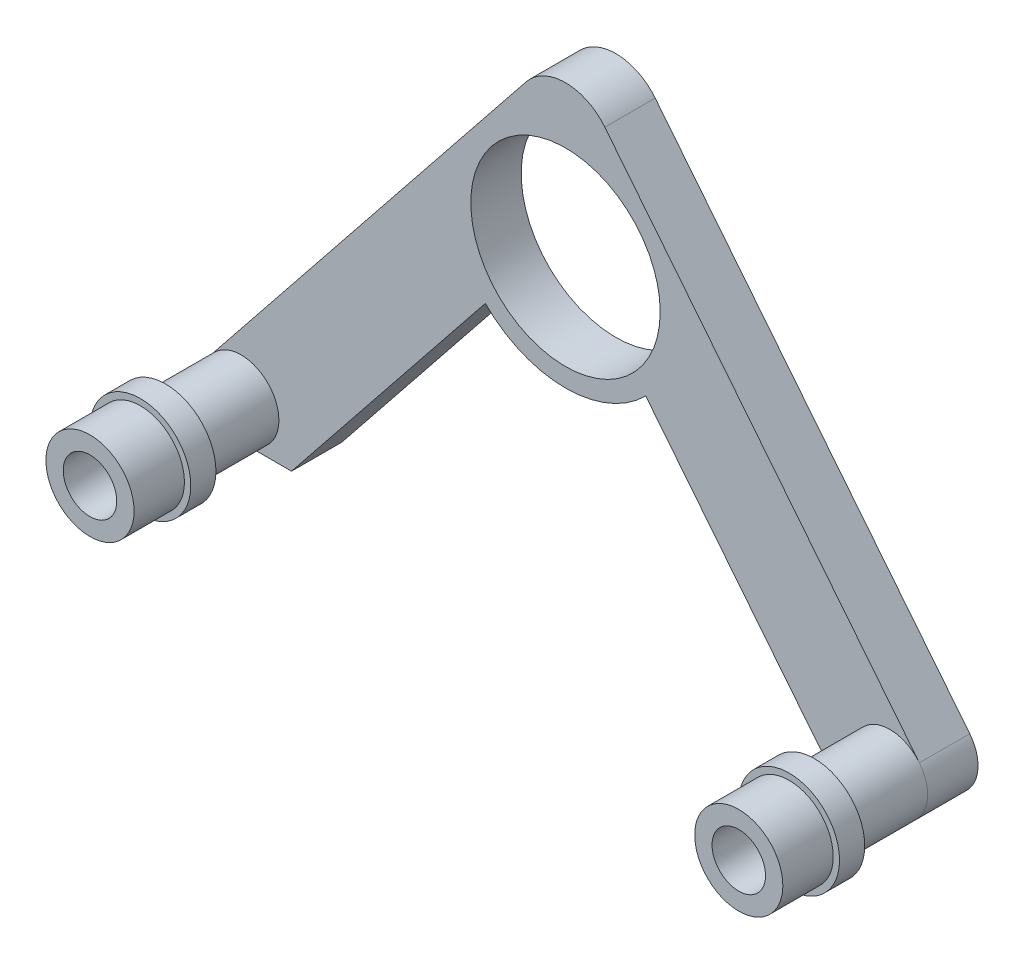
SolidWorks part; units mm, degrees
ref_plane "Front Plane" through (0, 0, 0) normal (0, 0, 1) x (1, 0, 0)
ref_plane "Top Plane" through (0, 0, 0) normal (0, 1, 0) x (1, 0, 0)
ref_plane "Right Plane" through (0, 0, 0) normal (1, 0, 0) x (0, 0, -1)
sketch "Sketch1" plane through (0, 0, 0) normal (0, 0, 1) x (1, 0, 0)
  line L0 (-101.6, 0) -> (0, 127)
  line L3 (-101.6, 0) -> (101.6, 0)
  line L7 (0, 127) -> (101.6, 0)
  point P0 (0, 0)
  point P4 (0, 0)
  dimension "D1" = 203.2
  dimension "D2" = 127
extrude "Boss-Extrude1" add sketch "Sketch1" along normal blind 12.7
sketch "Sketch2" plane through (0, 0, 12.7) normal (0, 0, 1) x (1, 0, 0)
  line L0 (-69.0721, 0) -> (0, 86.3402)
  line L1 (-101.6, 0) -> (101.6, 0) construction
  line L2 (0, 86.3402) -> (69.0721, 0)
  line L3 (69.0721, 0) -> (-69.0721, 0)
  line L4 (0, 127) -> (-101.6, 0) construction
  line L5 (101.6, 0) -> (0, 127) construction
  point P4 (0, 0)
  dimension "D1" = 25.4
extrude "Cut-Extrude1" cut sketch "Sketch2" against normal blind 12.7
sketch "Sketch3" plane through (0, 0, 0) normal (0, 0, -1) x (-1, 0, 0)
  line L0 (0, 127) -> (101.6, 0) construction
  line L1 (-101.6, 0) -> (0, 127) construction
  circle A0 centre (0, 81.2577) radius 28.575
  dimension "D1" = 57.15
sketch "Sketch4" plane through (0, 0, 12.7) normal (0, 0, 1) x (1, 0, 0)
  line L0 (0, 127) -> (-101.6, 0) construction
  line L1 (-101.6, 0) -> (-69.0721, 0) construction
  line L2 (101.6, 0) -> (0, 127) construction
  line L3 (69.0721, 0) -> (101.6, 0) construction
  circle A0 centre (-81.782, 9.525) radius 9.525
  circle A1 centre (81.782, 9.525) radius 9.525
  dimension "D1" = 19.05
  dimension "D2" = 19.05
extrude "Boss-Extrude3" add sketch "Sketch4" along normal blind 38.1
fillet "Fillet2" radius 12.7 1 edges at (0, 127, 6.35)
fillet "Fillet3" radius 9.525 1 edges at (101.6, 0, 6.35)
fillet "Fillet4" radius 9.525 1 edges at (-101.6, 0, 6.35)
sketch "Sketch5" plane through (0, 0, 50.8) normal (0, 0, 1) x (1, 0, 0)
  circle A0 centre (-81.782, 9.525) radius 12.7
  circle A1 centre (81.782, 9.525) radius 12.7
  dimension "D1" = 25.4
extrude "Boss-Extrude4" add sketch "Sketch5" against normal blind 19.05
sketch "Sketch6" plane through (0, 0, 50.8) normal (0, 0, 1) x (1, 0, 0)
  circle A0 centre (-81.782, 9.525) radius 11.1125
  circle A1 centre (81.782, 9.525) radius 11.1125
  circle A2 centre (-81.782, 9.525) radius 12.7
  circle A3 centre (81.782, 9.525) radius 12.7
  circle A4 centre (81.782, 9.525) radius 12.7 construction
  dimension "D1" = 22.225
extrude "Cut-Extrude2" cut sketch "Sketch6" against normal blind 12.7
sketch "Sketch7" plane through (0, 0, 50.8) normal (0, 0, 1) x (1, 0, 0)
  circle A0 centre (-81.782, 9.525) radius 6.7437
  circle A1 centre (81.782, 9.525) radius 6.7437
  dimension "D1" = 13.4874
extrude "Cut-Extrude3" cut sketch "Sketch7" against normal up to next
extrude "Boss-Extrude5" add sketch "Sketch3" against normal up to surface (12.7 mm away)
sketch "Sketch8" plane through (0, 0, 12.7) normal (0, 0, 1) x (1, 0, 0)
  circle A0 centre (0, 81.2577) radius 23.876
  arc A3 (-20.2194, 61.0659) -> (20.2194, 61.0659) centre (0, 81.2577) ccw construction
  point P2 (0, 0)
  point P3 (0, 0)
  dimension "D1" = 47.752
extrude "Cut-Extrude4" cut sketch "Sketch8" against normal up to surface (12.7 mm away)
